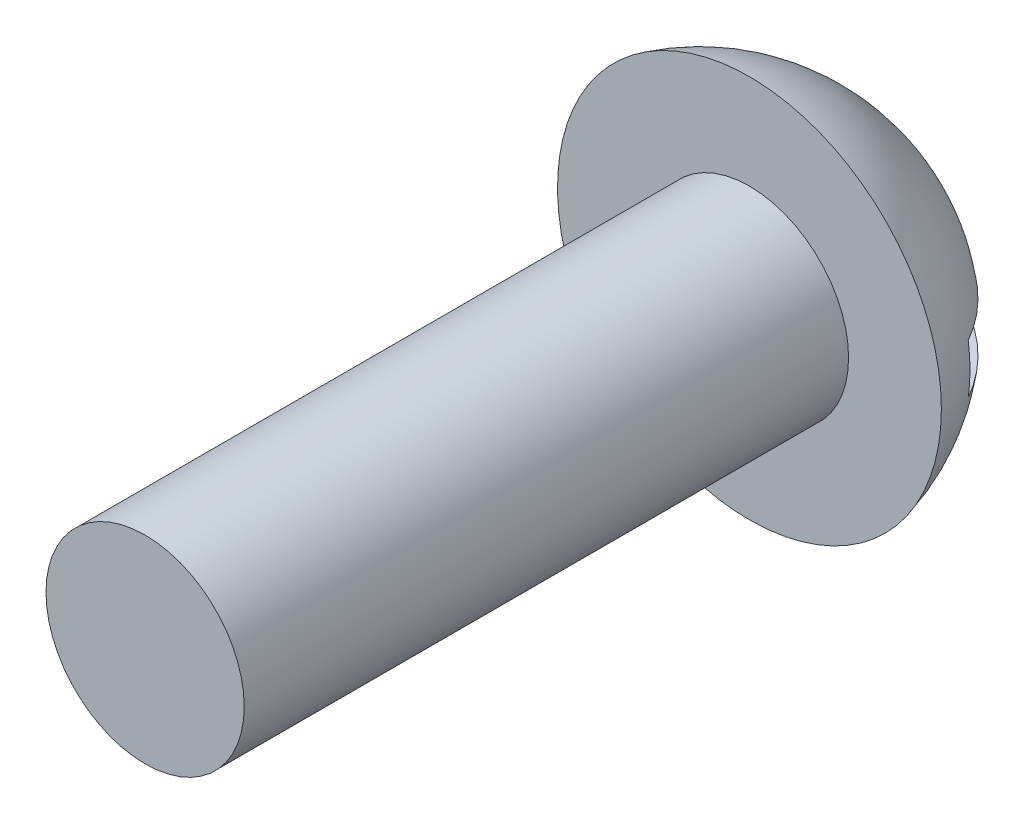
SolidWorks part; units mm, degrees
ref_plane "Plane1" through (0, 0, 0) normal (0, 0, 1) x (1, 0, 0)
ref_plane "Plane2" through (0, 0, 0) normal (0, 1, 0) x (1, 0, 0)
ref_plane "Plane3" through (0, 0, 0) normal (1, 0, 0) x (0, 0, -1)
sketch "Sketch1" plane through (0, 0, 0) normal (1, 0, 0) x (0, 0, -1)
  line L0 (-22.86, 15.2822) -> (-19.7358, 15.2822)
  line L1 (-28.5941, 15.2822) -> (6.9659, 15.2822) construction
  line L2 (-22.86, 19.3155) -> (-22.86, 15.2822)
  arc A0 (-19.7358, 15.2822) -> (-22.86, 19.3155) centre (-23.9014, 15.2822) ccw
  dimension "D2" = 4.1656
  dimension "D1" = 3.1242
revolve "Base-Revolve" add sketch "Sketch1" angle 360 about L1
sketch "Sketch2" plane through (0, 0, 22.86) normal (0, 0, 1) x (1, 0, 0)
  circle A0 centre (0, 15.24) radius 2.0828
  dimension "D1" = 4.1656
extrude "Boss-Extrude1" add sketch "Sketch2" along normal blind 12.7
sketch "Sketch4" plane through (0, 0, 0) normal (1, 0, 0) x (0, 0, -1)
  line L2 (-21.8513, 14.7615) -> (-19.7685, 14.7615)
  line L3 (-21.8513, 15.8029) -> (-19.7685, 15.8029)
  line L4 (-21.8513, 15.8029) -> (-21.8513, 14.7615)
  arc A1 (-22.86, 11.2488) -> (-22.86, 19.3155) centre (-23.9014, 15.2822) ccw construction
  arc A2 (-19.7685, 14.7615) -> (-19.7685, 15.8029) centre (-23.9014, 15.2822) ccw
  dimension "D1" = 2.0828
  dimension "D2" = 1.0414
  dimension "D3" = 0.5207
extrude "Cut-Extrude1" cut sketch "Sketch4" against normal through all
mirror "Mirror1" about plane through (0, 15.2822, 23.9014) normal (1, 0, 0) of "Cut-Extrude1"
equation "\"D1@Sketch1\"=(3/4)*\"D1@Sketch2\""
equation "\"D2@Sketch1\"=\"D1@Sketch2\""
equation "\"D1@Sketch4\"=.5*\"D1@Sketch2\""
equation "\"D2@Sketch4\"=.25*\"D1@Sketch2\""
equation "\"D3@Sketch4\"=(1/8)*\"D1@Sketch2\""
